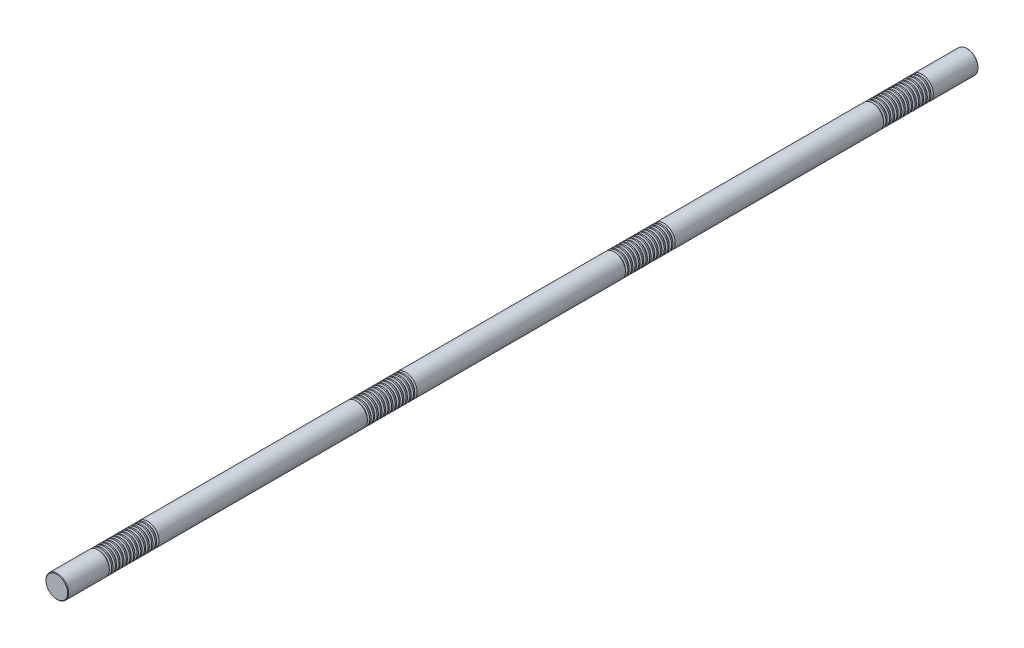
SolidWorks part; units mm, degrees
ref_plane "Front Plane" through (0, 0, 0) normal (0, 0, 1) x (1, 0, 0)
ref_plane "Top Plane" through (0, 0, 0) normal (0, 1, 0) x (1, 0, 0)
ref_plane "Right Plane" through (0, 0, 0) normal (1, 0, 0) x (0, 0, -1)
sketch "Sketch1" plane through (0, 0, 0) normal (0, 0, 1) x (1, 0, 0)
  circle A0 centre (0, 0) radius 25
  dimension "D1" = 50
extrude "Boss-Extrude1" add sketch "Sketch1" along normal mid plane 2000
chamfer "Chamfer1" distance 1.25 angle 45 2 edges at (25, 0, -1000) (25, 0, 1000)
sketch "Sketch2" plane through (0, 0, 0) normal (1, 0, 0) x (0, 0, -1)
  line L0 (900.6029, 25) -> (895.3971, 25)
  line L1 (998.75, 25) -> (-998.75, 25) construction
  line L2 (895.3971, 25) -> (896.6029, 20.5)
  line L3 (896.6029, 20.5) -> (899.3971, 20.5)
  line L4 (899.3971, 20.5) -> (900.6029, 25)
  line L5 (1000, -23.75) -> (1000, 23.75) construction
  point P4 (898, 25)
  point P7 (898, 20.5)
  point P8 (900, 22.75)
  point P9 (896, 22.75)
  dimension "D1" = 4
  dimension "D2" = 100
  dimension "D3" = 4.5
  dimension "D4" = 30
revolve "Cut-Revolve1" cut sketch "Sketch2" angle 360 about axis through (0, 0, 1000) along (0, 0, -1)
pattern_linear "LPattern1" count 14 spacing 8 along (0, 0, 1) of "Cut-Revolve1"
pattern_linear "LPattern2" count 4 spacing 567 along (0, 0, 1) of "Cut-Revolve1", "LPattern1"
